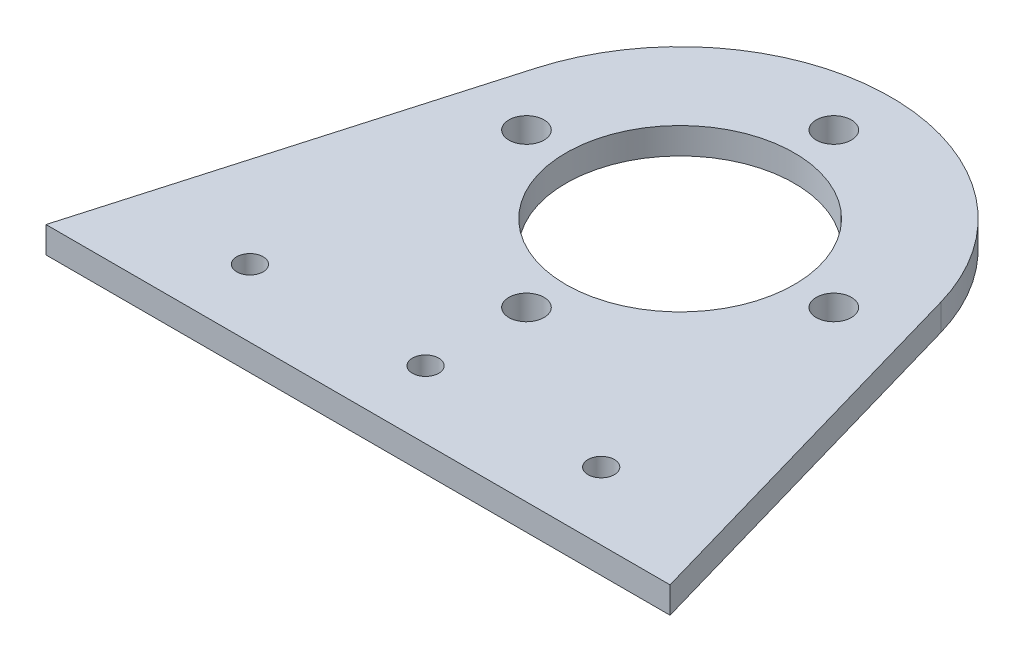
SolidWorks part; units mm, degrees
ref_plane "前视基准面" through (0, 0, 0) normal (0, 0, 1) x (1, 0, 0)
ref_plane "上视基准面" through (0, 0, 0) normal (0, 1, 0) x (1, 0, 0)
ref_plane "右视基准面" through (0, 0, 0) normal (1, 0, 0) x (0, 0, -1)
sketch "草图1" plane through (0, 0, 0) normal (0, 1, 0) x (1, 0, 0)
  line L0 (-3.8341, 8.4311) -> (-16.3023, -34.888)
  line L1 (-16.3023, -34.888) -> (54.7614, -34.888)
  line L2 (54.7614, -34.888) -> (42.2933, 8.4311)
  arc A0 (42.2933, 8.4311) -> (-3.8341, 8.4311) centre (19.2296, 1.7929) ccw
  circle A1 centre (19.2296, 1.7929) radius 13
  circle A2 centre (19.2296, -27.197) radius 1.5
  circle A3 centre (-0.7704, -27.197) radius 1.5
  circle A4 centre (39.2296, -27.197) radius 1.5
  circle A5 centre (19.2296, 1.7929) radius 17.5 construction
  circle A6 centre (19.2296, 19.2929) radius 2
  circle A7 centre (36.7296, 1.7929) radius 2
  circle A8 centre (19.2296, -15.7071) radius 2
  circle A9 centre (1.7296, 1.7929) radius 2
  point P24 (19.2296, 1.7929)
  dimension "D1" = 4
extrude "凸台-拉伸1" add sketch "草图1" along normal blind 3
